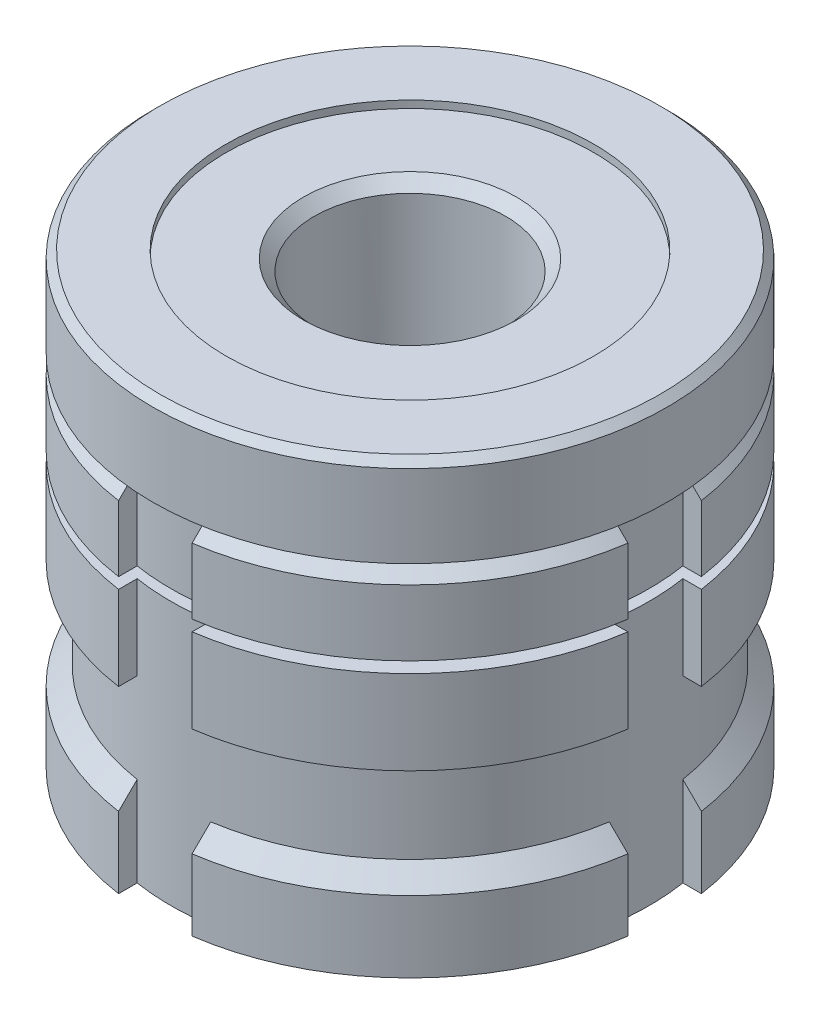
SolidWorks part; units mm, degrees
ref_plane "Front Plane" through (0, 0, 0) normal (0, 0, 1) x (1, 0, 0)
ref_plane "Top Plane" through (0, 0, 0) normal (0, 1, 0) x (1, 0, 0)
ref_plane "Right Plane" through (0, 0, 0) normal (1, 0, 0) x (0, 0, -1)
sketch "Sketch1" plane through (0, 0, 0) normal (0, 1, 0) x (1, 0, 0)
  circle A0 centre (0, 0) radius 35
  dimension "D1" = 70
extrude "Boss-Extrude1" add sketch "Sketch1" along normal blind 24.4
sketch "Sketch2" plane through (0, 0, 0) normal (1, 0, 0) x (0, 0, -1)
  line L0 (0, 13.2648) -> (0, -2.3994) construction
  line L1 (-35, 0) -> (35, 0) construction
  line L2 (-35, 12.95) -> (-25, 12.95)
  line L3 (-35, 12.95) -> (-35, 11.45)
  line L4 (-35, 11.45) -> (-25, 11.45)
  line L5 (-25, 12.95) -> (-25, 11.45)
  line L6 (-35, 12.95) -> (-25, 11.45) construction
  line L7 (-35, 11.45) -> (-25, 12.95) construction
  point P3 (-30, 12.2)
  point P8 (-35, 12.2)
  dimension "D1" = 1.5
  dimension "D2" = 35
  dimension "D3" = 25
  dimension "D4" = 12.2
revolve "Cut-Revolve1" cut sketch "Sketch2" angle 360 about L0
sketch "Sketch3" plane through (0, 0, 0) normal (0, -1, 0) x (1, 0, 0)
  circle A0 centre (0, 0) radius 32.5
  dimension "D1" = 65
extrude "Boss-Extrude2" add sketch "Sketch3" along normal blind 24.4
sketch "Sketch4" plane through (0, -24.4, 0) normal (0, -1, 0) x (1, 0, 0)
  circle A0 centre (0, 0) radius 35
  circle A1 centre (0, 0) radius 35 construction
extrude "Boss-Extrude3" add sketch "Sketch4" against normal blind 12.2
sketch "Sketch5" plane through (0, 24.4, 0) normal (0, 1, 0) x (1, 0, 0)
  line L0 (-34.641, 5) -> (-32.1131, 5)
  line L2 (-32.1131, -5) -> (-34.641, -5)
  line L3 (-5, 34.641) -> (-5, 32.1131)
  line L5 (5, 32.1131) -> (5, 34.641)
  line L6 (32.1131, 5) -> (34.641, 5)
  line L8 (34.641, -5) -> (32.1131, -5)
  line L9 (-5, -32.1131) -> (-5, -34.641)
  line L11 (5, -34.641) -> (5, -32.1131)
  arc A0 (-32.1131, 5) -> (-32.1131, -5) centre (0, 0) ccw
  circle A1 centre (0, 0) radius 32.5 construction
  arc A2 (-34.641, 5) -> (-34.641, -5) centre (0, 0) ccw
  circle A3 centre (0, 0) radius 35 construction
  arc A4 (-5, -32.1131) -> (5, -32.1131) centre (0, 0) ccw
  arc A5 (-5, -34.641) -> (5, -34.641) centre (0, 0) ccw
  arc A6 (32.1131, -5) -> (32.1131, 5) centre (0, 0) ccw
  arc A7 (34.641, -5) -> (34.641, 5) centre (0, 0) ccw
  arc A8 (5, 32.1131) -> (-5, 32.1131) centre (0, 0) ccw
  arc A9 (5, 34.641) -> (-5, 34.641) centre (0, 0) ccw
  point P1 (-35, 0)
  point P5 (-32.5, 0)
  point P25 (0, 0)
  dimension "D1" = 10
extrude "Cut-Extrude4" cut sketch "Sketch5" against normal up to surface (48.8 mm away)
chamfer "Chamfer1" distance 2.5 angle 45 8 edges at (-24.7487, -12.2, -24.7487) (24.7487, -12.2, -24.7487) (-24.7487, 24.4, -24.7487) (24.7487, 24.4, -24.7487) (24.7487, 24.4, 24.7487) (24.7487, -12.2, 24.7487) (-24.7487, -12.2, 24.7487) (-24.7487, 24.4, 24.7487)
sketch "Sketch6" plane through (0, 24.4, 0) normal (0, 1, 0) x (1, 0, 0)
  circle A0 centre (0, 0) radius 35
  arc A1 (5, -34.641) -> (34.641, -5) centre (0, 0) ccw construction
extrude "Boss-Extrude4" add sketch "Sketch6" along normal blind 12.2
chamfer "Chamfer2" distance 1 angle 45 1 edges at (0, 36.6, 35)
sketch "Sketch7" plane through (0, 36.6, 0) normal (0, 1, 0) x (1, 0, 0)
  circle A0 centre (0, 0) radius 25
  dimension "D1" = 50
extrude "Cut-Extrude5" cut sketch "Sketch7" against normal blind 1
sketch "Sketch8" plane through (0, 35.6, 0) normal (0, 1, 0) x (1, 0, 0)
  circle A0 centre (0, 0) radius 13
  dimension "D1" = 26
extrude "Cut-Extrude6" cut sketch "Sketch8" against normal up to surface (60 mm away)
chamfer "Chamfer3" distance 1.5 angle 45 2 edges at (0, -24.4, -13) (0, 35.6, 13)
